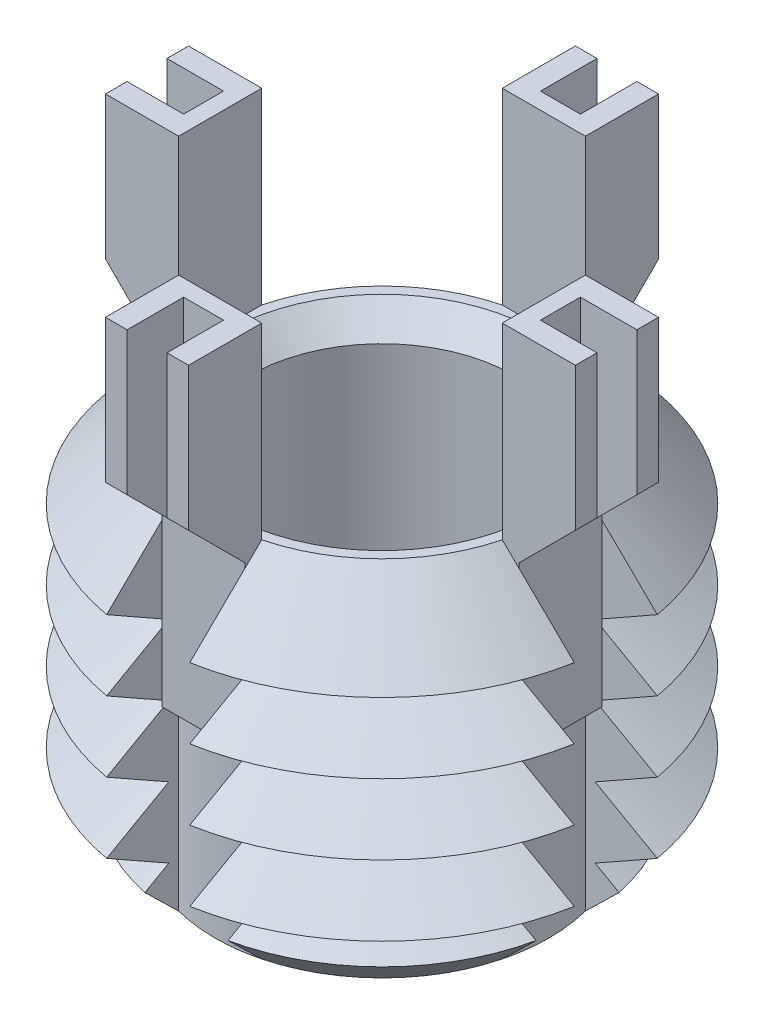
SolidWorks part; units mm, degrees
ref_plane "Front Plane" through (0, 0, 0) normal (0, 0, 1) x (1, 0, 0)
ref_plane "Top Plane" through (0, 0, 0) normal (0, 1, 0) x (1, 0, 0)
ref_plane "Right Plane" through (0, 0, 0) normal (1, 0, 0) x (0, 0, -1)
sketch "Sketch1" plane through (0, 0, 0) normal (0, 1, 0) x (1, 0, 0)
  circle A0 centre (0, 0) radius 7.144
  dimension "D1" = 14.288
extrude "Boss-Extrude1" add sketch "Sketch1" against normal blind 10.922
chamfer "Chamfer1" distance 2.117 angle 45 2 edges at (0, -10.922, 7.144) (0, 0, 7.144)
sketch "Sketch2" plane through (0, 0, 0) normal (1, 0, 0) x (0, 0, -1)
  line L0 (0, 0.8859) -> (0, -9.2617) construction
sketch "Sketch3" plane through (0, 0, 0) normal (1, 0, 0) x (0, 0, -1)
  line L0 (-7.144, -2.117) -> (-5.3106, -3.1755)
  line L1 (-5.3106, -3.1755) -> (-7.144, -4.234)
  line L2 (-7.144, -2.117) -> (-7.144, -8.805) construction
  line L3 (-7.144, -4.234) -> (-7.144, -2.117)
  dimension "D1" = 2.117
revolve "Cut-Revolve1" cut sketch "Sketch3" angle 360 about L0
pattern_linear "LPattern1" count 4 spacing 2.117 along (0, -1, 0) of "Cut-Revolve1"
sketch "Sketch4" plane through (0, 0, 0) normal (0, 1, 0) x (1, 0, 0)
  line L0 (-4.8691, 1.25) -> (-7.0338, 1.25)
  line L2 (-7.0338, -1.25) -> (-4.8691, -1.25)
  arc A0 (-4.8691, 1.25) -> (-4.8691, -1.25) centre (0, 0) ccw
  arc A1 (-7.0338, 1.25) -> (-7.0338, -1.25) centre (0, 0) ccw
  circle A2 centre (0, 0) radius 7.144 construction
  circle A3 centre (0, 0) radius 5.027 construction
  point P1 (-5.027, 0)
  point P3 (-7.144, 0)
  point P13 (0, 0)
  dimension "D1" = 2.5
extrude "Cut-Extrude1" cut sketch "Sketch4" against normal up to surface (10.922 mm away)
pattern_circular "CirPattern1" count 4 over 360 about axis through (0, 0, 0) along (0, 1, 0) of "Cut-Extrude1"
sketch "Sketch5" plane through (0, 0, 0) normal (1, 0, 0) x (0, 0, -1)
  line L0 (-4.8691, 5.649) -> (-4.8691, -5.351)
  line L1 (-4.8691, -5.351) -> (-5.3691, -5.351)
  line L2 (-5.3691, -5.351) -> (-5.3691, -0.351)
  line L3 (-5.3691, -0.351) -> (-7.0691, 1.349)
  line L4 (-7.0691, 1.349) -> (-7.0691, 5.649)
  line L5 (-7.0691, 5.649) -> (-4.8691, 5.649)
  line L6 (-7.0338, -6.351) -> (-1.25, -6.351) construction
  point P9 (-1.25, 0)
  point P10 (-5.3691, -0.351)
  dimension "D1" = 1
  dimension "D2" = 11
  dimension "D3" = 6
  dimension "D4" = 2.2
  dimension "D5" = 0.5
  dimension "D6" = 45
extrude "Boss-Extrude3" add sketch "Sketch5" along normal mid plane 2.5
pattern_circular "CirPattern2" count 4 over 360 about axis through (0, 0, 0) along (0, 1, 0) of "Boss-Extrude3"
sketch "Sketch6" plane through (0, 5.649, 0) normal (0, 1, 0) x (1, 0, 0)
  line L0 (-7.0691, -1.25) -> (-7.0691, 1.25) construction
  line L1 (-7.0691, -0.6) -> (-5.3691, -0.6)
  line L2 (-7.0691, -0.6) -> (-7.0691, 0.6)
  line L3 (-7.0691, 0.6) -> (-5.3691, 0.6)
  line L4 (-5.3691, -0.6) -> (-5.3691, 0.6)
  line L5 (-7.0691, -0.6) -> (-5.3691, 0.6) construction
  line L6 (-7.0691, 0.6) -> (-5.3691, -0.6) construction
  line L7 (7.0691, 1.25) -> (7.0691, -1.25) construction
  line L8 (-0.6, 5.3691) -> (0.6, 5.3691)
  line L9 (-0.6, 5.3691) -> (-0.6, 7.0691)
  line L10 (-0.6, 7.0691) -> (0.6, 7.0691)
  line L11 (0.6, 5.3691) -> (0.6, 7.0691)
  line L12 (-0.6, 5.3691) -> (0.6, 7.0691) construction
  line L13 (-0.6, 7.0691) -> (0.6, 5.3691) construction
  line L14 (5.3691, -0.6) -> (7.0691, -0.6)
  line L15 (5.3691, -0.6) -> (5.3691, 0.6)
  line L16 (5.3691, 0.6) -> (7.0691, 0.6)
  line L17 (7.0691, -0.6) -> (7.0691, 0.6)
  line L18 (5.3691, -0.6) -> (7.0691, 0.6) construction
  line L19 (5.3691, 0.6) -> (7.0691, -0.6) construction
  line L20 (-0.6, -7.0691) -> (0.6, -7.0691)
  line L21 (-0.6, -7.0691) -> (-0.6, -5.3691)
  line L22 (-0.6, -5.3691) -> (0.6, -5.3691)
  line L23 (0.6, -7.0691) -> (0.6, -5.3691)
  line L24 (-0.6, -7.0691) -> (0.6, -5.3691) construction
  line L25 (-0.6, -5.3691) -> (0.6, -7.0691) construction
  line L26 (-1.25, 7.0691) -> (1.25, 7.0691) construction
  line L27 (1.25, -7.0691) -> (-1.25, -7.0691) construction
  point P0 (-6.2191, 0)
  point P7 (-7.0691, 0)
  point P8 (-7.0691, 0)
  point P9 (0, 6.2191)
  point P14 (6.2191, 0)
  point P19 (0, -6.2191)
  point P24 (0, 7.0691)
  point P25 (7.0691, 0)
  point P26 (7.0691, 0)
  point P27 (0, 7.0691)
  point P30 (0, -7.0691)
  point P33 (0, -7.0691)
  dimension "D1" = 1.2
  dimension "D2" = 1.7
extrude "Cut-Extrude3" cut sketch "Sketch6" against normal through all both and the other way through all
sketch "Sketch7" plane through (0, 0, 0) normal (0, 1, 0) x (1, 0, 0)
  circle A0 centre (0, 0) radius 3.969
  dimension "D1" = 7.938
extrude "Cut-Extrude4" cut sketch "Sketch7" against normal up to surface (10.922 mm away)
chamfer "Chamfer2" distance 0.755 angle 45 2 edges at (0, 0, 3.969) (0, -10.922, 3.969)
